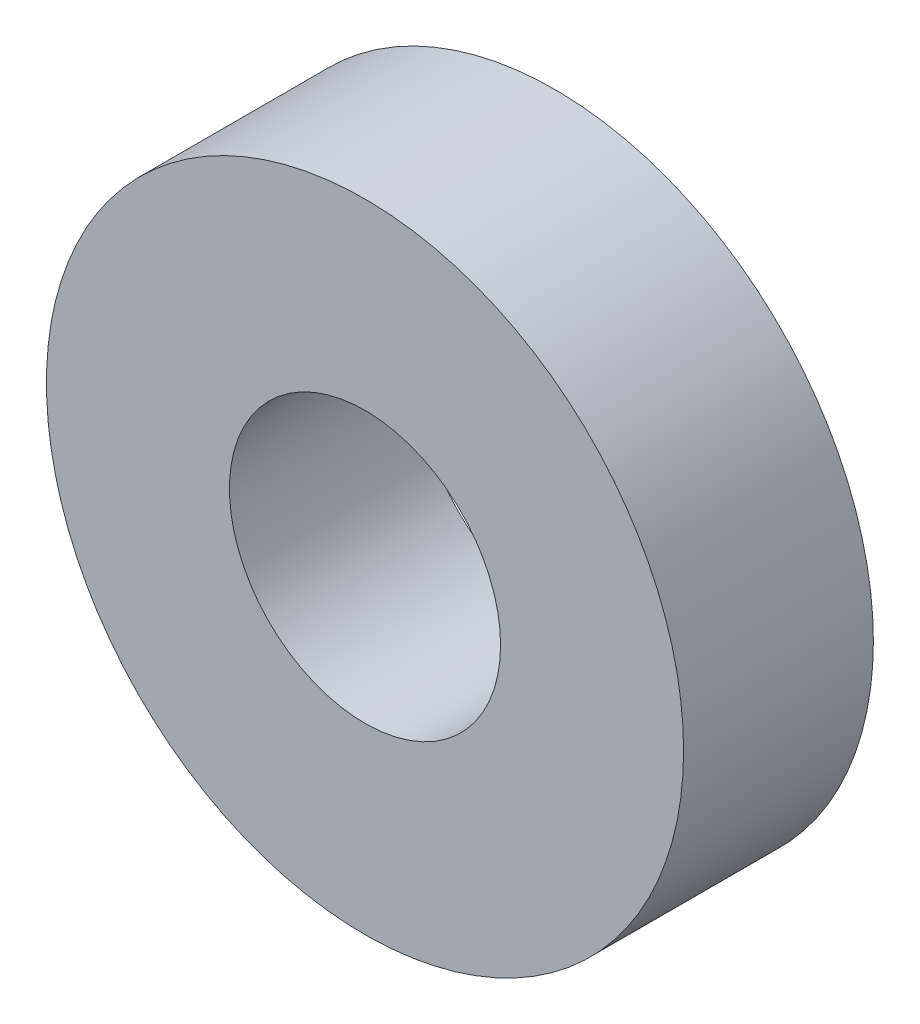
SolidWorks part; units mm, degrees
ref_plane "Plan de face" through (0, 0, 0) normal (0, 0, 1) x (1, 0, 0)
ref_plane "Plan de dessus" through (0, 0, 0) normal (0, 1, 0) x (1, 0, 0)
ref_plane "Plan de droite" through (0, 0, 0) normal (1, 0, 0) x (0, 0, -1)
sketch "Esquisse1" plane through (0, 0, 0) normal (0, 0, 1) x (1, 0, 0)
  circle A0 centre (0, 0) radius 23.5
  circle A1 centre (0, 0) radius 10
  dimension "D1" = 47
  dimension "D2" = 20
extrude "Extrusion1" add sketch "Esquisse1" along normal blind 14
